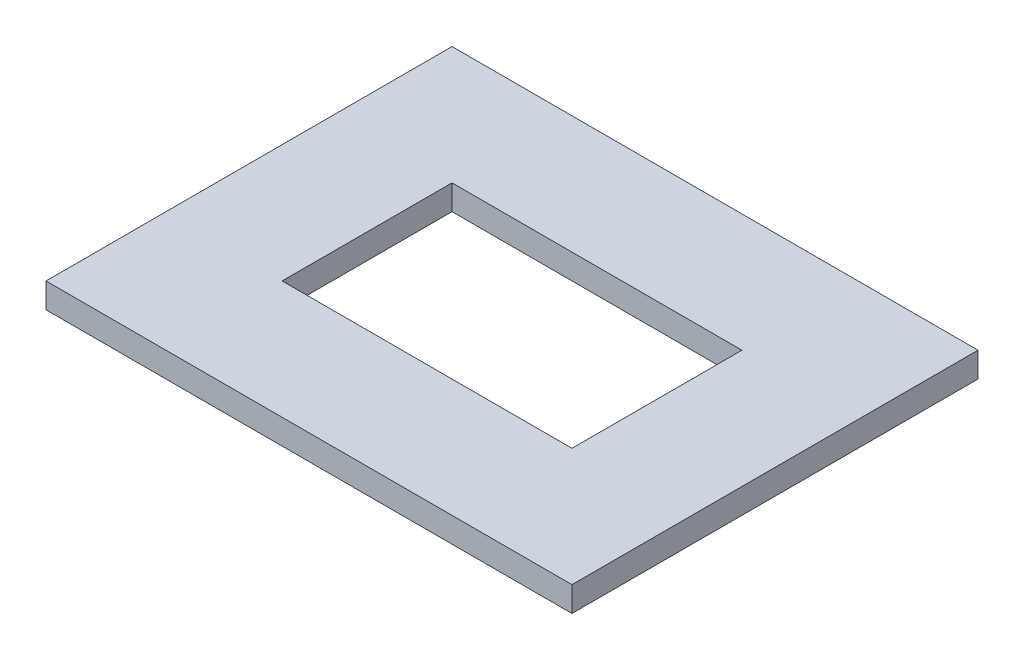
SolidWorks part; units mm, degrees
ref_plane "Front Plane" through (0, 0, 0) normal (0, 0, 1) x (1, 0, 0)
ref_plane "Top Plane" through (0, 0, 0) normal (0, 1, 0) x (1, 0, 0)
ref_plane "Right Plane" through (0, 0, 0) normal (1, 0, 0) x (0, 0, -1)
sketch "Sketch1" plane through (0, 0, 0) normal (0, 1, 0) x (1, 0, 0)
  line L1 (92.075, -53.975) -> (-92.075, -53.975)
  line L2 (92.075, -53.975) -> (92.075, 53.975)
  line L3 (92.075, 53.975) -> (-92.075, 53.975)
  line L4 (-92.075, -53.975) -> (-92.075, 53.975)
  line L5 (92.075, -53.975) -> (-92.075, 53.975) construction
  line L6 (92.075, 53.975) -> (-92.075, -53.975) construction
  line L7 (167.075, -128.975) -> (-167.075, -128.975)
  line L8 (167.075, -128.975) -> (167.075, 128.975)
  line L9 (167.075, 128.975) -> (-167.075, 128.975)
  line L10 (-167.075, -128.975) -> (-167.075, 128.975)
  line L11 (167.075, -128.975) -> (-167.075, 128.975) construction
  line L12 (167.075, 128.975) -> (-167.075, -128.975) construction
  point P0 (0, 0)
  point P6 (0, 0)
  dimension "D1" = 107.95
  dimension "D2" = 184.15
  dimension "D3" = 75
  dimension "D4" = 75
extrude "Boss-Extrude1" add sketch "Sketch1" along normal blind 15.875
